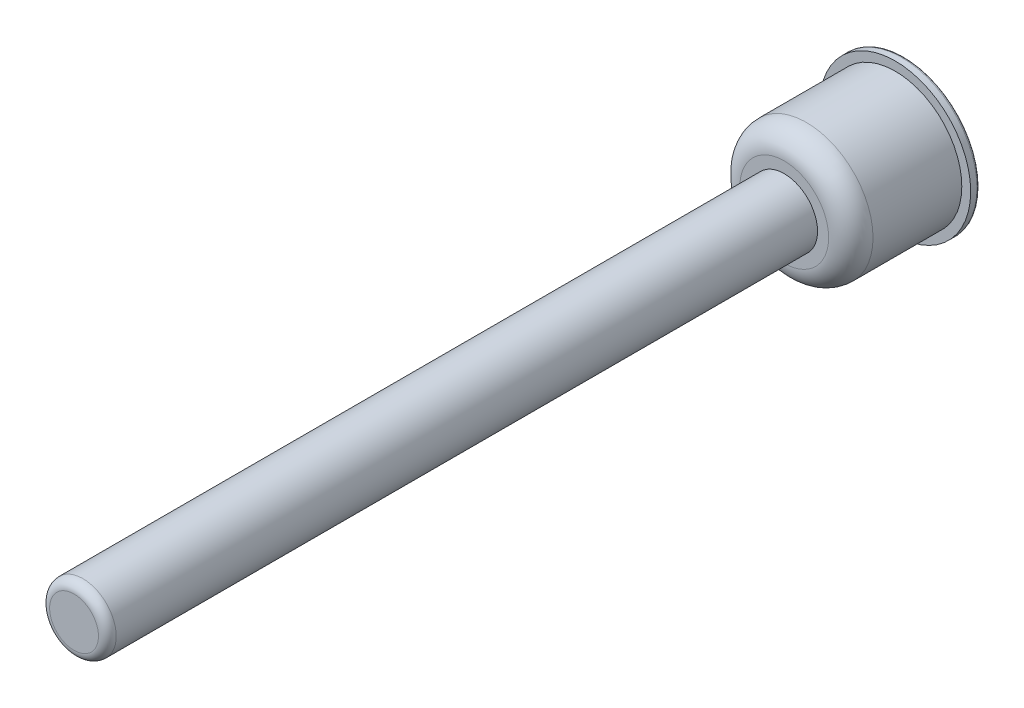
SolidWorks part; units mm, degrees
ref_plane "Front Plane" through (0, 0, 0) normal (0, 0, 1) x (1, 0, 0)
ref_plane "Top Plane" through (0, 0, 0) normal (0, 1, 0) x (1, 0, 0)
ref_plane "Right Plane" through (0, 0, 0) normal (1, 0, 0) x (0, 0, -1)
sketch "Sketch1" plane through (0, 0, 0) normal (0, 0, 1) x (1, 0, 0)
  circle A0 centre (0, 0) radius 21.59
  dimension "D1" = 43.18
extrude "Boss-Extrude1" add sketch "Sketch1" along normal blind 2.54
ref_plane "Plane1" through (0, 0, 2.54) normal (0, 0, 1) x (1, 0, 0)
sketch "Sketch4" plane through (0, 0, 2.54) normal (0, 0, 1) x (1, 0, 0)
  circle A0 centre (0, 0) radius 19.05
  dimension "D1" = 38.1
extrude "Boss-Extrude2" add sketch "Sketch4" along normal blind 31.75
sketch "Sketch3" plane through (0, 0, 0) normal (0, 0, 1) x (1, 0, 0)
  line L1 (-6.35, 6.35) -> (6.35, 6.35)
  line L2 (-6.35, 6.35) -> (-6.35, -6.35)
  line L3 (-6.35, -6.35) -> (6.35, -6.35)
  line L4 (6.35, 6.35) -> (6.35, -6.35)
  line L5 (-6.35, 6.35) -> (6.35, -6.35) construction
  line L6 (-6.35, -6.35) -> (6.35, 6.35) construction
  point P0 (0, 0)
  dimension "D1" = 12.7
  dimension "D2" = 12.7
extrude "Cut-Extrude2" cut sketch "Sketch3" along normal blind 19.05
ref_plane "Plane2" through (0, 0, 34.29) normal (0, 0, 1) x (1, 0, 0)
sketch "Sketch5" plane through (0, 0, 34.29) normal (0, 0, 1) x (1, 0, 0)
  circle A0 centre (0, 0) radius 9.525
  dimension "D1" = 19.05
extrude "Boss-Extrude3" add sketch "Sketch5" along normal blind 203.2
fillet "Fillet2" radius 6.35 1 edges at (19.05, 0, 34.29)
fillet "Fillet1" radius 0.762 1 edges at (21.59, 0, 0)
fillet "Fillet3" radius 2.54 1 edges at (9.525, 0, 237.49)
